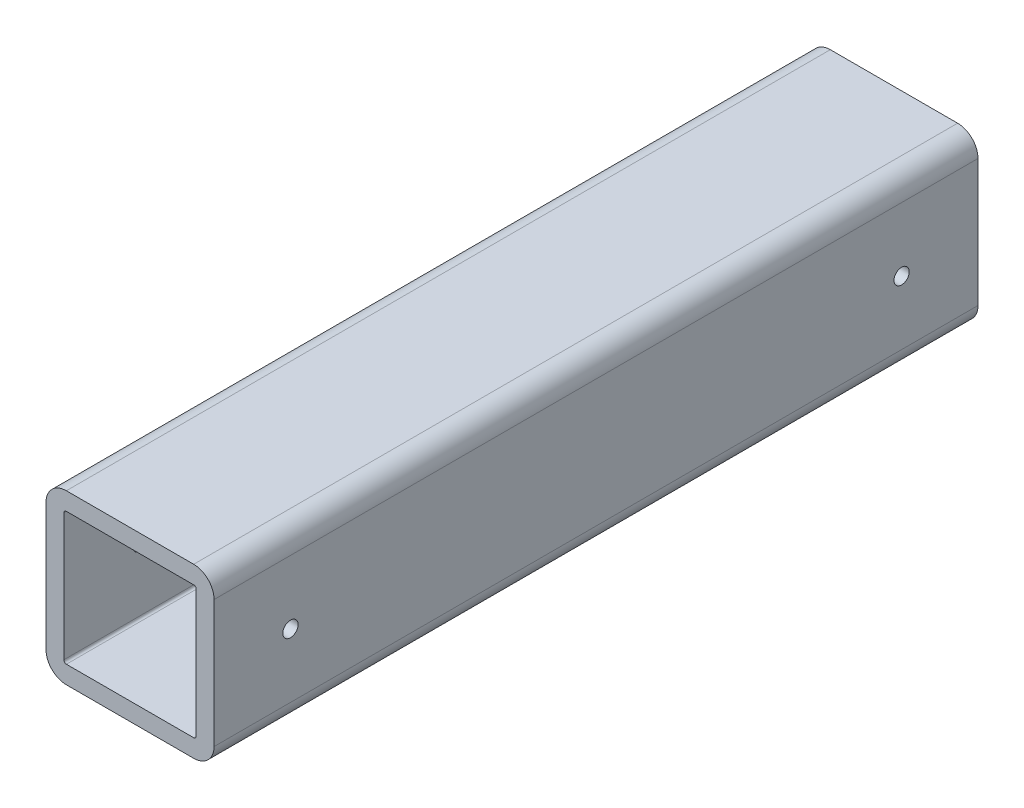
SolidWorks part; units mm, degrees
ref_plane "Face" through (0, 0, 0) normal (0, 0, 1) x (1, 0, 0)
ref_plane "Dessus" through (0, 0, 0) normal (0, 1, 0) x (1, 0, 0)
ref_plane "Droite" through (0, 0, 0) normal (1, 0, 0) x (0, 0, -1)
sketch "Esquisse2" plane through (0, 0, 0) normal (0, 0, 1) x (1, 0, 0)
  line L0 (8, -7) -> (58, -7)
  line L1 (8, 0) -> (58, 0)
  line L2 (0, -8) -> (0, -58)
  line L3 (8, -66) -> (58, -66)
  line L4 (66, -8) -> (66, -58)
  line L5 (59, -8) -> (59, -58)
  line L6 (8, -59) -> (58, -59)
  line L7 (7, -8) -> (7, -58)
  arc A0 (58, -66) -> (66, -58) centre (58, -58) ccw
  arc A1 (0, -58) -> (8, -66) centre (8, -58) ccw
  arc A2 (8, 0) -> (0, -8) centre (8, -8) ccw
  arc A3 (66, -8) -> (58, 0) centre (58, -8) ccw
  arc A4 (59, -8) -> (58, -7) centre (58, -8) ccw
  arc A5 (58, -59) -> (59, -58) centre (58, -58) ccw
  arc A6 (7, -58) -> (8, -59) centre (8, -58) ccw
  arc A7 (8, -7) -> (7, -8) centre (8, -8) ccw
  point P9 (0, -66)
  point P12 (0, 0)
  point P15 (66, 0)
  dimension "D3" = 8
  dimension "D1" = 66
  dimension "D2" = 66
  dimension "D4" = 7
extrude "Base-Extrusion" add sketch "Esquisse2" along normal blind 300
sketch "Esquisse3" plane through (0, 0, 0) normal (-1, 0, 0) x (0, 0, 1)
  line L0 (300, 0) -> (0, 0) construction
  line L1 (0, -8) -> (0, -58) construction
  line L2 (300, -8) -> (300, -58) construction
  circle A0 centre (30, -33) radius 3
  circle A1 centre (270, -33) radius 3
  dimension "D1" = 6
  dimension "D2" = 33
  dimension "D3" = 30
  dimension "D4" = 30
extrude "Enlèv. mat.-Extru.1" cut sketch "Esquisse3" against normal through all
